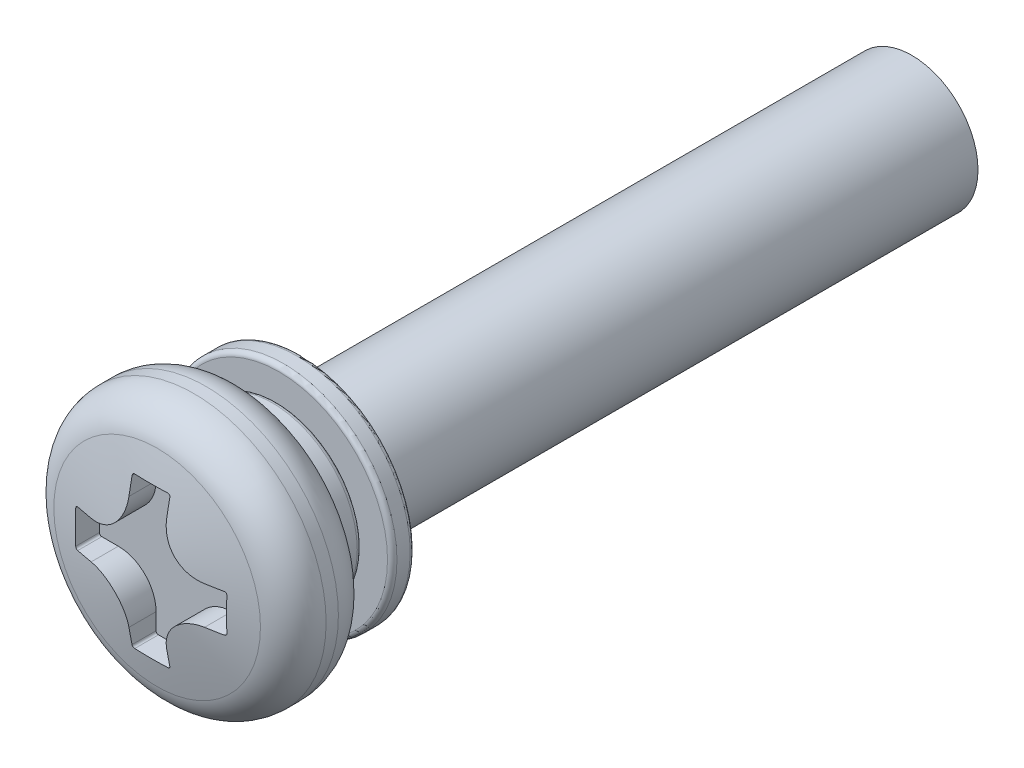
SolidWorks part; units mm, degrees
other "<Yellow Handles_Bolts>-<Fillet2>"
other "<Yellow Handles_Bolts>-<Fillet1>"
other "<Yellow Handles_Bolts>-<Cut-Extrude1>"
ref_plane "Front Plane" through (0, 0, 0) normal (0, 0, 1) x (1, 0, 0)
ref_plane "Top Plane" through (0, 0, 0) normal (0, 1, 0) x (1, 0, 0)
ref_plane "Right Plane" through (0, 0, 0) normal (1, 0, 0) x (0, 0, -1)
mirrored part "Yellow Handles_Bolts_Mirrored"
